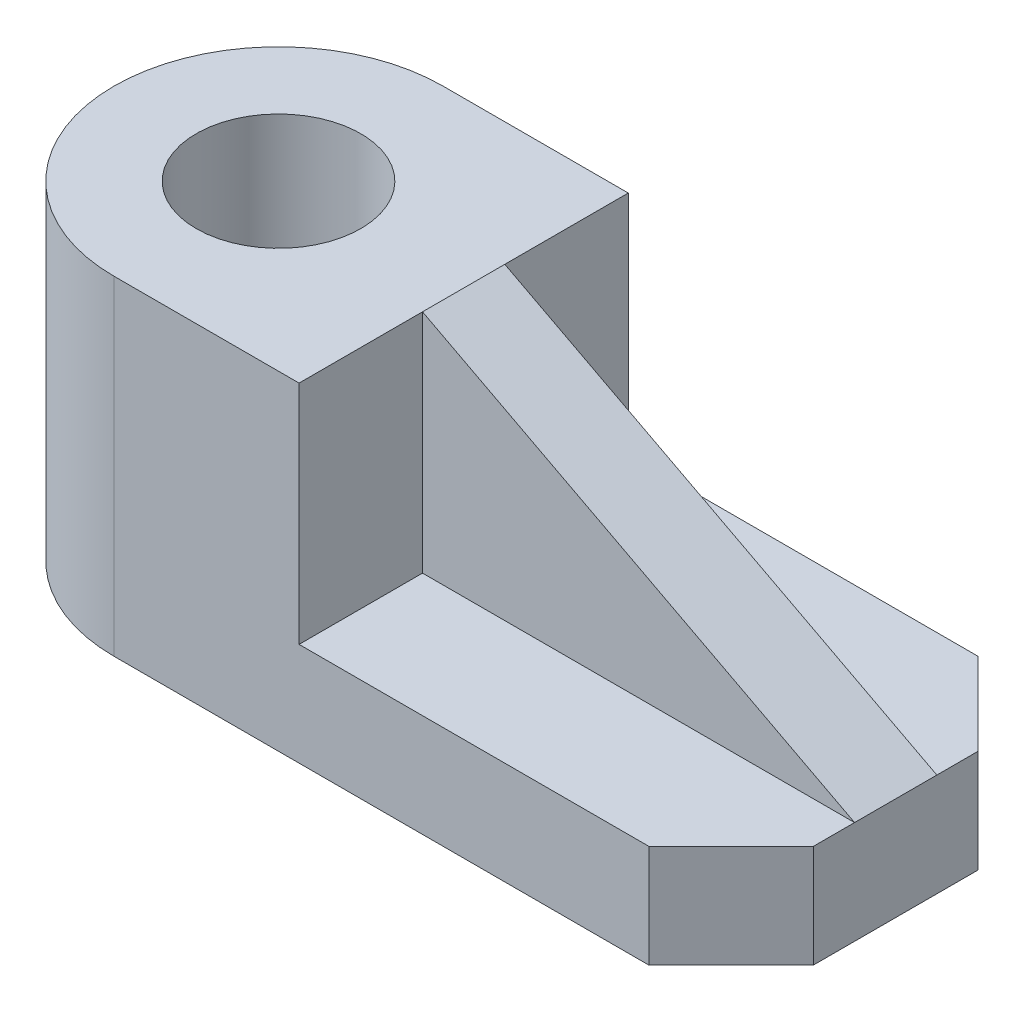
SolidWorks part; units mm, degrees
ref_plane "Front Plane" through (0, 0, 0) normal (0, 0, 1) x (1, 0, 0)
ref_plane "Top Plane" through (0, 0, 0) normal (0, 1, 0) x (1, 0, 0)
ref_plane "Right Plane" through (0, 0, 0) normal (1, 0, 0) x (0, 0, -1)
sketch "Sketch1" plane through (0, 0, 0) normal (0, 1, 0) x (1, 0, 0)
  line L0 (0, 16) -> (60, 16)
  line L1 (60, 16) -> (60, -16)
  line L2 (60, -16) -> (0, -16)
  arc A0 (0, -16) -> (0, 16) centre (0, 0) cw
  dimension "D1" = 16
  dimension "D2" = 60
extrude "Boss-Extrude1" add sketch "Sketch1" along normal blind 10
sketch "Sketch2" plane through (0, 10, 0) normal (0, 1, 0) x (1, 0, 0)
  line L0 (60, 16) -> (0, 16) construction
  line L1 (0, 16) -> (18, 16)
  line L2 (18, 16) -> (18, -16)
  line L3 (0, -16) -> (60, -16) construction
  line L4 (18, -16) -> (0, -16)
  arc A0 (0, -16) -> (0, 16) centre (0, 0) cw
  dimension "D1" = 18
extrude "Boss-Extrude2" add sketch "Sketch2" along normal blind 22
sketch "Sketch3" plane through (0, 32, 0) normal (0, 1, 0) x (1, 0, 0)
  circle A0 centre (0, 0) radius 8
  dimension "D1" = 16
extrude "Cut-Extrude1" cut sketch "Sketch3" against normal through all
sketch "Sketch4" plane through (0, 0, 0) normal (0, 0, 1) x (1, 0, 0)
  line L0 (18, 32) -> (60, 10)
rib "Rib1" sketch "Sketch4" sketch "Sketch4" thickness 8 extrusion direction parallel to sketch draft on no parameters "D1"=8
chamfer "Chamfer1" distance 8 angle 45 2 edges at (60, 5, -16) (60, 5, 16)
